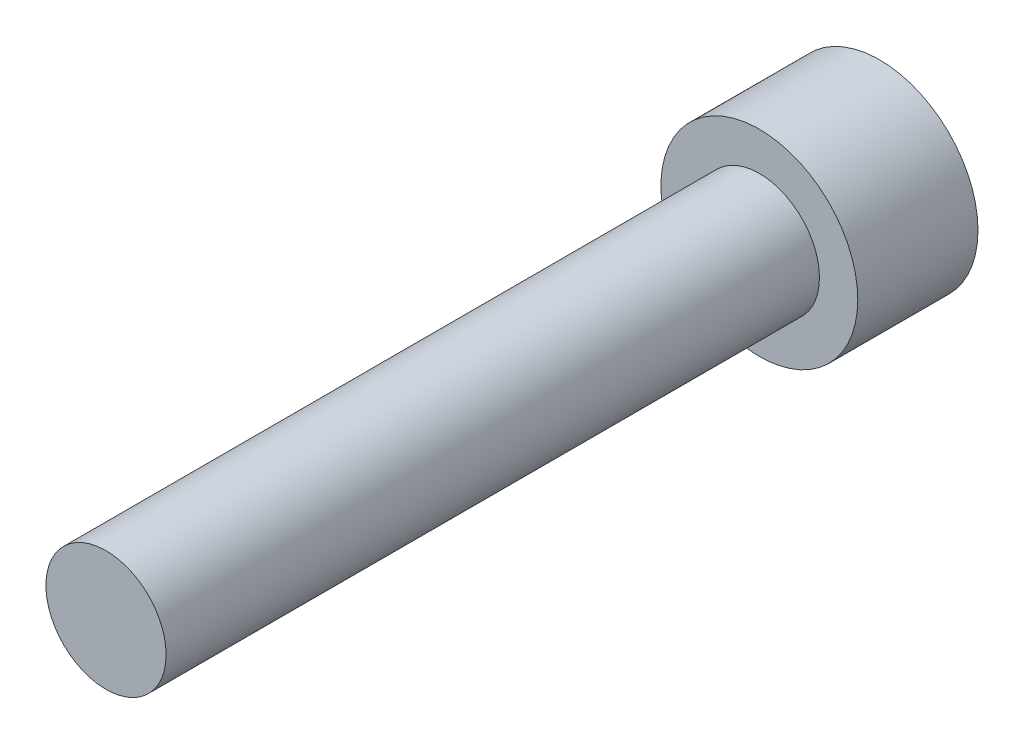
SolidWorks part; units mm, degrees
ref_plane "Front Plane" through (0, 0, 0) normal (0, 0, 1) x (1, 0, 0)
ref_plane "Top Plane" through (0, 0, 0) normal (0, 1, 0) x (1, 0, 0)
ref_plane "Right Plane" through (0, 0, 0) normal (1, 0, 0) x (0, 0, -1)
sketch "Sketch6" plane through (0, 0, 0) normal (1, 0, 0) x (0, 0, -1)
  line L0 (-19.05, 0) -> (22.525, 0) construction
  line L1 (3.1572, 0) -> (-3.1572, 0) construction
  line L2 (-19.05, 0) -> (-19.05, -1.7526)
  line L3 (-19.05, -1.7526) -> (0, -1.7526)
  line L4 (0, 3.1572) -> (0, -3.1572) construction
  line L5 (0, -1.7526) -> (0, -2.8702)
  line L6 (0, -2.8702) -> (3.5052, -2.8702)
  line L7 (3.5052, -2.8702) -> (3.5052, 0)
  line L8 (3.5052, 0) -> (-19.05, 0)
  dimension "L" = 19.05
  dimension "H" = 3.5052
  dimension "A" = 5.7404
  dimension "D" = 3.5052
revolve "Revolve1" add sketch "Sketch6" angle 360 about L0
sketch "Sketch7" plane through (0, 0, -3.5052) normal (0, 0, -1) x (-1, 0, 0)
  line L2 (-1.3843, 0.7992) -> (-1.3843, -0.7992)
  line L4 (-1.3843, -0.7992) -> (0, -1.5985)
  line L5 (0, -1.5985) -> (1.3843, -0.7992)
  line L6 (1.3843, -0.7992) -> (1.3843, 0.7992)
  line L7 (1.3843, 0.7992) -> (0, 1.5985)
  line L8 (0, 1.5985) -> (-1.3843, 0.7992)
  circle A0 centre (0, 0) radius 1.3843 construction
  dimension "J" = 2.7686
extrude "HEX" cut sketch "Sketch7" against normal blind 2.032
